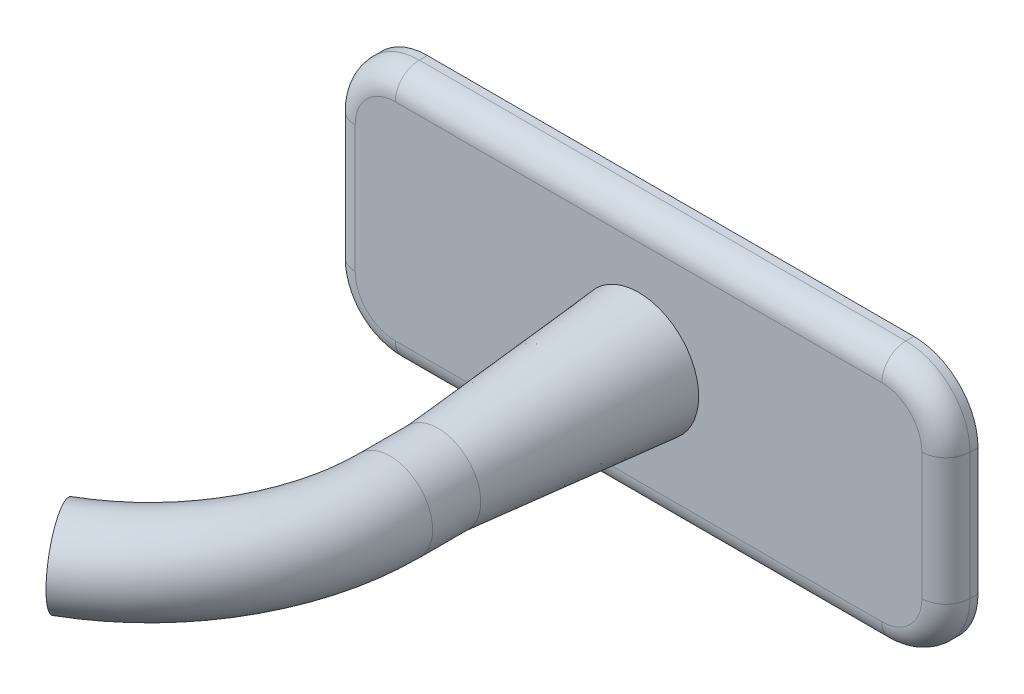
SolidWorks part; units mm, degrees
ref_plane "Front Plane" through (0, 0, 0) normal (0, 0, 1) x (1, 0, 0)
ref_plane "Top Plane" through (0, 0, 0) normal (0, 1, 0) x (1, 0, 0)
ref_plane "Right Plane" through (0, 0, 0) normal (1, 0, 0) x (0, 0, -1)
sketch "Sketch1" plane through (0, 0, 0) normal (0, 0, 1) x (1, 0, 0)
  line L0 (-9.741, 4.0424) -> (9.741, -4.0424) construction
  line L1 (-9.741, 4.0424) -> (9.741, 4.0424)
  line L2 (-9.741, 4.0424) -> (-9.741, -4.0424)
  line L3 (-9.741, -4.0424) -> (9.741, -4.0424)
  line L4 (9.741, 4.0424) -> (9.741, -4.0424)
  dimension "D1" = 19.482
  dimension "D2" = 8.0848
extrude "Boss-Extrude1" add sketch "Sketch1" along normal blind 1.016
fillet "Fillet1" radius 2.032 4 edges at (-9.741, 4.0424, 0.508) (-9.741, -4.0424, 0.508) (9.741, 4.0424, 0.508) (9.741, -4.0424, 0.508)
fillet "Fillet2" radius 0.762 8 edges at (-9.1458, -3.4473, 1.016) (-9.741, 0, 1.016) (-9.1458, 3.4473, 1.016) (0, 4.0424, 1.016) (9.1458, 3.4473, 1.016) (9.741, 0, 1.016) (9.1458, -3.4473, 1.016) (0, -4.0424, 1.016)
sketch "Sketch2" plane through (0, 0, 1.016) normal (0, 0, 1) x (1, 0, 0)
  circle A0 centre (0, 0) radius 1.905
  dimension "D1" = 3.81
extrude "Boss-Extrude2" add sketch "Sketch2" along normal blind 6.35 draft 5
sketch "Sketch3" plane through (0, 0, 7.366) normal (0, 0, 1) x (1, 0, 0)
  circle A1 centre (0, 0) radius 1.3494
  circle A2 centre (0, 0) radius 1.3494
  dimension "D1" = 0
extrude "Boss-Extrude3" add sketch "Sketch3" along normal blind 1.524
sketch "Sketch4" plane through (0, 0, 8.89) normal (0, 0, 1) x (1, 0, 0)
  line L0 (-7.62, -3.1618) -> (-7.62, 2.9767) construction
  circle A1 centre (0, 0) radius 1.3494
  circle A2 centre (0, 0) radius 1.3494
  dimension "D2" = 7.62
  dimension "D1" = 0
revolve "Revolve1" add sketch "Sketch4" angle 60 about L0
